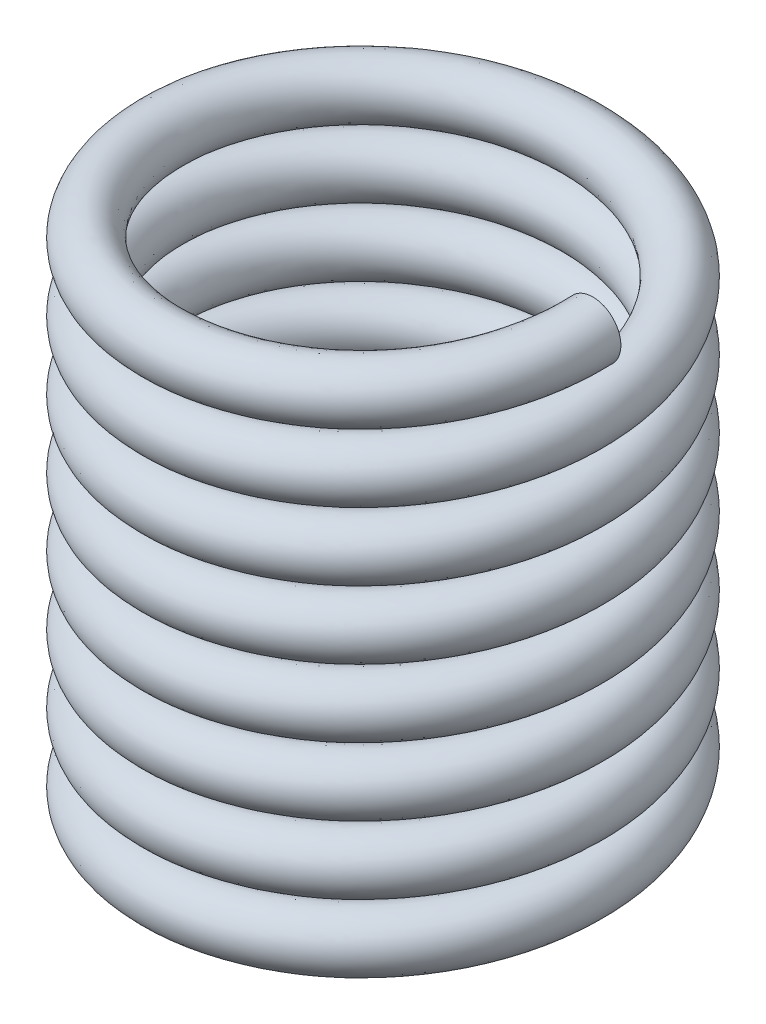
SolidWorks part; units mm, degrees
ref_plane "Front Plane" through (0, 0, 0) normal (0, 0, 1) x (1, 0, 0)
ref_plane "Top Plane" through (0, 0, 0) normal (0, 1, 0) x (1, 0, 0)
ref_plane "Right Plane" through (0, 0, 0) normal (1, 0, 0) x (0, 0, -1)
sketch "Sketch4" plane through (0, 0, 0) normal (0, 0, 1) x (1, 0, 0)
  line L0 (0, 0) -> (0, 18.1927)
  line L3 (-183.65, 18.1927) -> (-134.7303, 18.1927) construction
sketch "Sketch5" plane through (0, 0, 0) normal (0, 0, 1) x (1, 0, 0)
  circle A0 centre (-7.5, 0) radius 1
  dimension "D1" = 2
  dimension "D2" = 7.5
sweep "Sweep1" add profiles "Sketch5" path "Sketch4" parameters "D4"=2700
